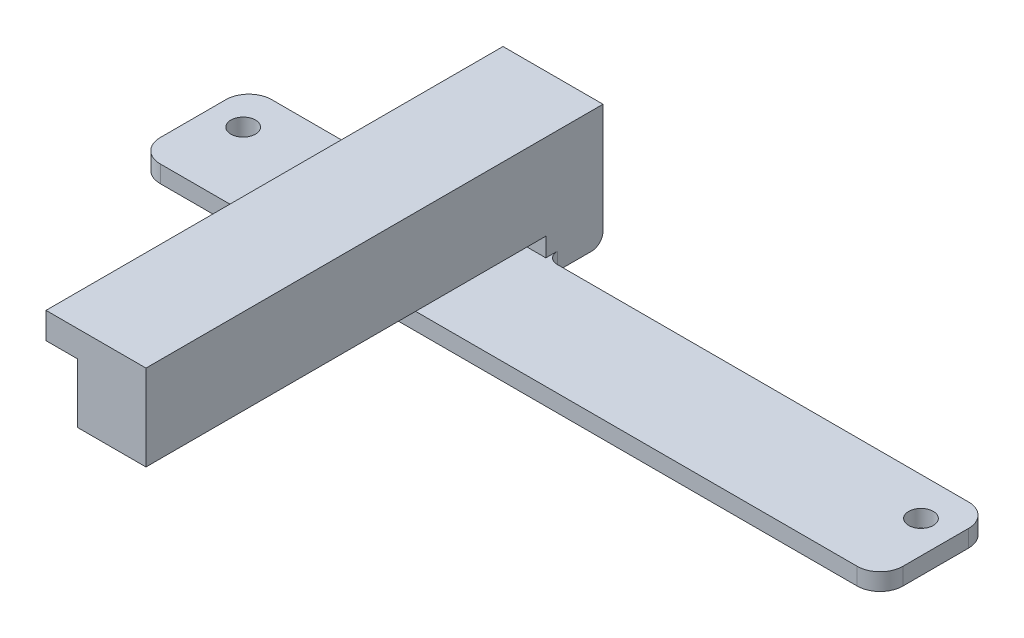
SolidWorks part; units mm, degrees
ref_plane "Front Plane" through (0, 0, 0) normal (0, 0, 1) x (1, 0, 0)
ref_plane "Top Plane" through (0, 0, 0) normal (0, 1, 0) x (1, 0, 0)
ref_plane "Right Plane" through (0, 0, 0) normal (1, 0, 0) x (0, 0, -1)
sketch "Sketch1" plane through (0, 0, 0) normal (0, 1, 0) x (1, 0, 0)
  line L1 (-65, -9.75) -> (65, -9.75)
  line L2 (-65, -9.75) -> (-65, 9.75)
  line L3 (-65, 9.75) -> (65, 9.75)
  line L4 (65, -9.75) -> (65, 9.75)
  line L5 (-65, -9.75) -> (65, 9.75) construction
  line L6 (-65, 9.75) -> (65, -9.75) construction
  point P0 (0, 0)
  dimension "D1" = 19.5
  dimension "D2" = 130
extrude "Boss-Extrude1" add sketch "Sketch1" along normal blind 3
fillet "Fillet1" radius 4 4 edges at (65, 1.5, 9.75) (-65, 1.5, 9.75) (-65, 1.5, -9.75) (65, 1.5, -9.75)
sketch "Sketch2" plane through (0, 3, 0) normal (0, 1, 0) x (1, 0, 0)
  line L0 (61, 9.75) -> (-61, 9.75) construction
  line L1 (-30.5, 9.75) -> (-13, 9.75)
  line L2 (-30.5, 9.75) -> (-30.5, 19.75)
  line L3 (-30.5, 19.75) -> (-13, 19.75)
  line L4 (-13, 9.75) -> (-13, 19.75)
  line L5 (65, -5.75) -> (65, 5.75) construction
  dimension "D1" = 78
  dimension "D2" = 95.5
  dimension "D3" = 10
extrude "Boss-Extrude2" add sketch "Sketch2" along normal blind 18.3 and the other way up to surface
sketch "Sketch3" plane through (0, 0, -9.75) normal (0, 0, 1) x (1, 0, 0)
  line L9 (-30.5, 3) -> (-30.5, 21.3) construction
  line L10 (-30.5, 16.7) -> (-25, 16.7)
  line L11 (-30.5, 16.7) -> (-30.5, 6.3)
  line L12 (-30.5, 6.3) -> (-25, 6.3)
  line L13 (-25, 16.7) -> (-25, 6.3)
  line L19 (-61, 3) -> (61, 3) construction
  dimension "D1" = 5.5
  dimension "D2" = 10.4
  dimension "D3" = 3.3
fillet "Fillet2" radius 2 2 edges at (-21.75, 0, -19.75) (-13, 1.5, -9.75)
sketch "Sketch4" plane through (0, 0, 0) normal (0, -1, 0) x (1, 0, 0)
  line L0 (0, 9.75) -> (0, -9.75) construction
  line L1 (-61, 9.75) -> (61, 9.75) construction
  line L2 (61, -9.75) -> (-11, -9.75) construction
  line L3 (-30.5, -9.75) -> (-61, -9.75) construction
  circle A0 centre (-59.325, -3.09) radius 2.15
  circle A1 centre (59.325, -3.09) radius 2.15
  dimension "D1" = 118.65
  dimension "D3" = 4.3
  dimension "D2" = 6.66
extrude "Cut-Extrude2" cut sketch "Sketch4" against normal up to surface (3 mm away)
extrude "Cut-Extrude3" cut sketch "Sketch3" against normal up to surface (10 mm away)
sketch "Sketch6" plane through (0, 0, -9.75) normal (0, 0, 1) x (1, 0, 0)
  line L0 (-30.5, 21.3) -> (-13, 21.3)
  line L1 (-13, 21.3) -> (-13, 6.3)
  line L2 (-13, 3) -> (-13, 21.3) construction
  line L3 (-13, 6.3) -> (-25, 6.3)
  line L4 (-25, 6.3) -> (-25, 16.7)
  line L5 (-25, 16.7) -> (-30.5, 16.7)
  line L6 (-30.5, 16.7) -> (-30.5, 21.3)
extrude "Boss-Extrude4" add sketch "Sketch6" along normal blind 70
